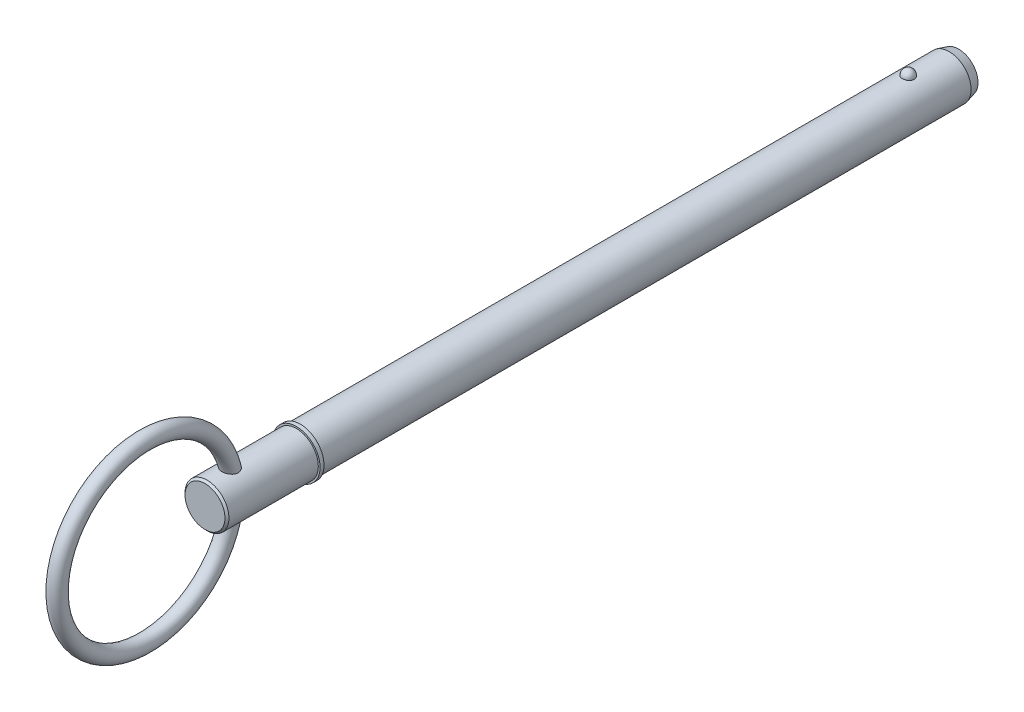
SolidWorks part; units mm, degrees
ref_plane "Front Plane" through (0, 0, 0) normal (0, 0, 1) x (1, 0, 0)
ref_plane "Top Plane" through (0, 0, 0) normal (0, 1, 0) x (1, 0, 0)
ref_plane "Right Plane" through (0, 0, 0) normal (1, 0, 0) x (0, 0, -1)
sketch "Sketch2" plane through (0, 0, 0) normal (0, 0, 1) x (1, 0, 0)
  circle A0 centre (0, 0) radius 5.555
  point P3 (0, 5.555)
  dimension "D1" = 11.11
extrude "Boss-Extrude1" add sketch "Sketch2" along normal blind 152.4
sketch "Sketch3" plane through (0, 0, 0) normal (0, 0, -1) x (-1, 0, 0)
  circle A0 centre (0, 0) radius 5.555
  dimension "D1" = 11.11
extrude "Boss-Extrude2" add sketch "Sketch3" along normal blind 14.27
chamfer "Chamfer1" distance 2.4 angle 15 1 edges at (-5.555, 0, -14.27)
sketch "Sketch18" plane through (0, 0, 0) normal (1, 0, 0) x (0, 0, -1)
  line L0 (11.87, 5.555) -> (-152.4, 5.555) construction
  line L1 (1.49, 7.045) -> (1.49, 4.065)
  line L2 (-152.4, -5.555) -> (11.87, -5.555) construction
  arc A0 (1.49, 7.045) -> (1.49, 4.065) centre (1.49, 5.555) ccw
  point P4 (0, 5.555)
  dimension "D1" = 12.6
revolve "Revolve1" add sketch "Sketch18" angle 360 about L1
sketch "Sketch19" plane through (0, 0, 0) normal (1, 0, 0) x (0, 0, -1)
  line L0 (-33.7288, 0) -> (-46.4542, 0) construction
sketch "Sketch20" plane through (0, 0, 0) normal (1, 0, 0) x (0, 0, -1)
  line L0 (-152.4, 0) -> (-152.4, 6)
  line L1 (-152.4, 5.555) -> (-152.4, -5.555) construction
  line L2 (-152.4, 6) -> (-153.4, 6)
  line L3 (-153.4, 6) -> (-153.4, 0)
  line L4 (-33.7288, 0) -> (-46.4542, 0) construction
  line L5 (-153.4, 0) -> (-152.4, 0)
  dimension "D1" = 6
  dimension "D2" = 1
revolve "Revolve2" add sketch "Sketch20" angle 360 about L0
sketch "Sketch21" plane through (0, 0, 152.4) normal (0, 0, -1) x (-1, 0, 0)
  circle A0 centre (0, 0) radius 5.555
  dimension "D1" = 11.11
extrude "Boss-Extrude3" add sketch "Sketch21" against normal blind 24.13
chamfer "Chamfer2" distance 0.5 angle 45 1 edges at (-5.555, 0, 176.53)
sketch "Sketch23" plane through (0, 0, 0) normal (1, 0, 0) x (0, 0, -1)
  line L0 (-176.53, 5.055) -> (-176.53, -5.055) construction
  circle A0 centre (-191.755, 0) radius 22.225
  point P2 (-169.53, 0)
  dimension "D1" = 44.45
  dimension "D2" = 7
sketch "Sketch24" plane through (0, 0, 0) normal (0, 1, 0) x (1, 0, 0)
  circle A0 centre (0, -169.53) radius 2
  dimension "D1" = 4
sweep "Sweep1" add profiles "Sketch24" path "Sketch23"
